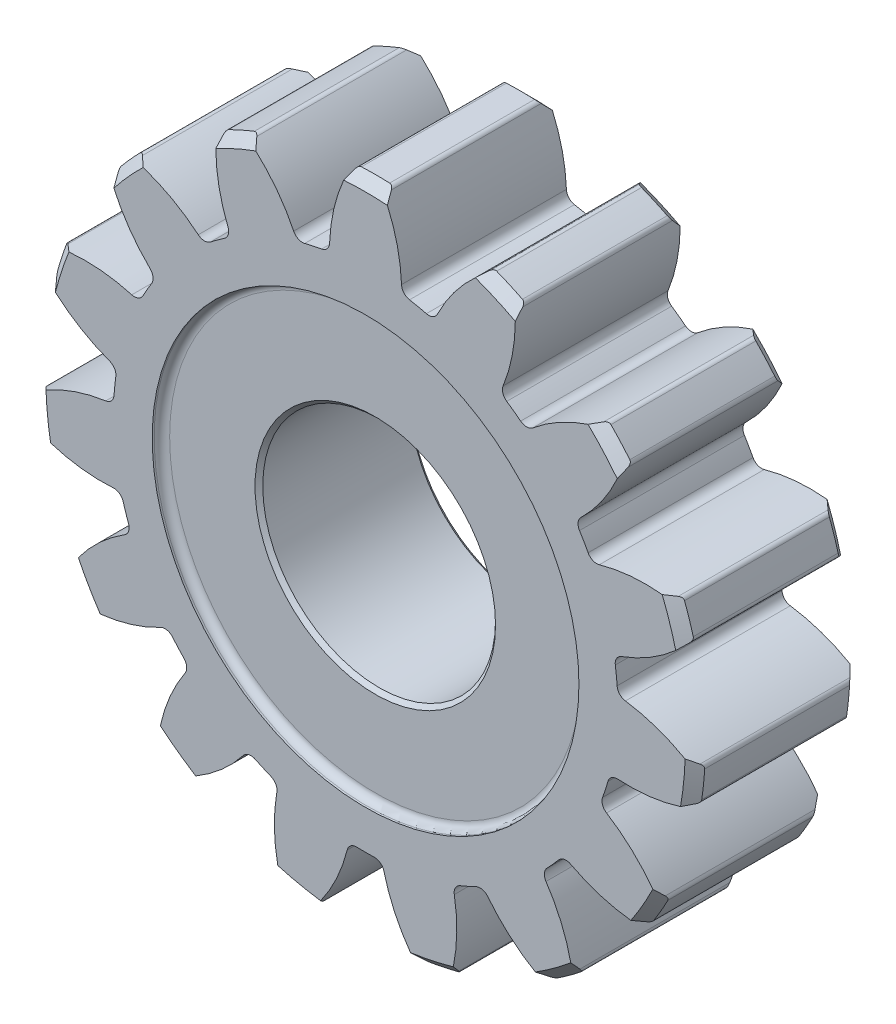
SolidWorks part; units mm, degrees
ref_plane "Plan1" through (0, 0, 0) normal (0, 0, 1) x (1, 0, 0)
ref_plane "Plan2" through (0, 0, 0) normal (0, 1, 0) x (1, 0, 0)
ref_plane "Plan3" through (0, 0, 0) normal (1, 0, 0) x (0, 0, -1)
sketch "Esquisse1" plane through (0, 0, 0) normal (0, 0, 1) x (1, 0, 0)
  circle A0 centre (0, 0) radius 6
  circle A1 centre (0, 0) radius 13
  dimension "D1" = 12
  dimension "D2" = 26
extrude "Base-Extrusion" add sketch "Esquisse1" along normal blind 8.5
sketch "Esquisse2" plane through (0, 0, 8.5) normal (0, 0, 1) x (1, 0, 0)
  line L0 (0, 0) -> (0, 18.851) construction
  arc A2 (0.7272, 16.9844) -> (-0.7272, 16.9844) centre (0, 0) ccw
  arc A3 (-0.94, 16.8466) -> (-1.8543, 13.2748) centre (6.8291, 12.9551) ccw
  arc A4 (0.94, 16.8466) -> (1.8543, 13.2748) centre (-6.8291, 12.9551) cw
  circle A5 centre (0, 0) radius 13 construction
  arc A6 (0.7272, 16.9844) -> (0.94, 16.8466) centre (0.7165, 16.7347) cw
  arc A7 (-0.7272, 16.9844) -> (-0.94, 16.8466) centre (-0.7165, 16.7347) ccw
  arc A8 (-2.2667, 12.8009) -> (-1.8543, 13.2748) centre (-2.3539, 13.2932) ccw
  arc A9 (2.2667, 12.8009) -> (1.8543, 13.2748) centre (2.3539, 13.2932) cw
  arc A10 (2.2667, 12.8009) -> (-2.2667, 12.8009) centre (0, 0) ccw
  point P8 (0.873, 16.9776)
  point P14 (-0.873, 16.9776)
  point P17 (-1.8597, 12.8663)
  point P20 (1.8597, 12.8663)
  dimension "D1" = 34
  dimension "D2" = 0.25
  dimension "D3" = 0.5
extrude "Boss.-Extru.2" add sketch "Esquisse2" against normal through all
pattern_circular "Répétition circulaire1" count 15 over 360 about axis through (0, 0, 0) along (0, 0, 1) of "Boss.-Extru.2"
sketch "Esquisse3" plane through (0, 0, 0) normal (1, 0, 0) x (0, 0, -1)
  line L0 (0, 0) -> (-12.2308, 0) construction
  line L3 (-8.5, 0) -> (0, 0) construction
  line L6 (-9.1661, 15.8184) -> (-7.5185, 17.466)
  line L8 (-7.5185, 17.466) -> (-9.1661, 17.466)
  line L10 (0.3516, 16.1328) -> (-0.9815, 17.466)
  line L12 (0.3516, 17.466) -> (0.3516, 16.1328)
  line L13 (0.3516, 17.466) -> (-0.9815, 17.466)
  line L14 (-9.1661, 17.466) -> (-9.1661, 15.8184)
revolve "Enlèvement de matière-Révolution1" cut sketch "Esquisse3" angle 360 about L0
sketch "Esquisse4" plane through (0, 0, 8.5) normal (0, 0, 1) x (1, 0, 0)
  circle A0 centre (0, 0) radius 11
  dimension "D1" = 22
extrude "Extrusion1" cut sketch "Esquisse4" against normal blind 0.5
chamfer "Chanfrein1" distance 0.2 angle 45 2 edges at (6, 0, 8) (6, 0, 0)
fillet "Congé1" radius 0.4 1 edges at (11, 0, 8)
other "Bloquer***"
